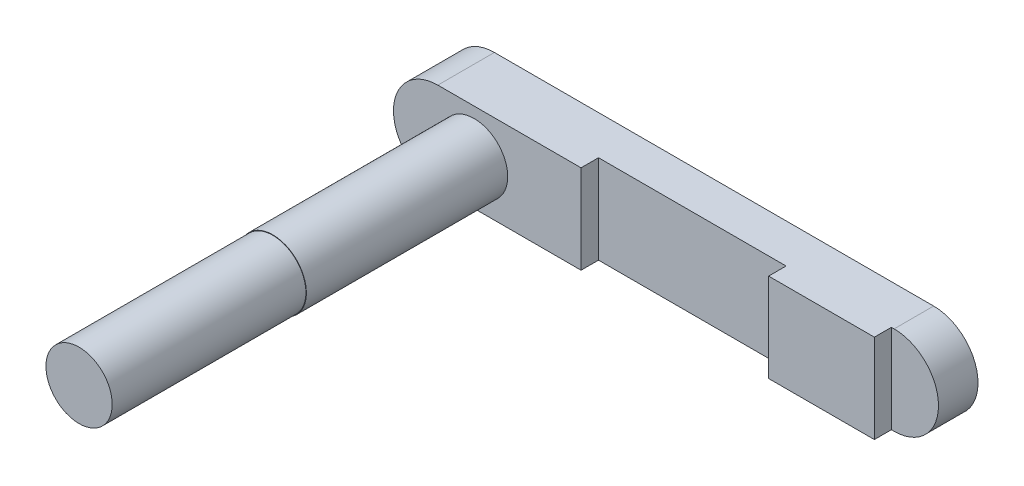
SolidWorks part; units mm, degrees
ref_plane "front" through (0, 0, 0) normal (0, 0, 1) x (1, 0, 0)
ref_plane "top" through (0, 0, 0) normal (0, 1, 0) x (1, 0, 0)
ref_plane "side" through (0, 0, 0) normal (1, 0, 0) x (0, 0, -1)
sketch "Sketch1" plane through (0, 0, 0) normal (0, 0, 1) x (1, 0, 0)
  line L0 (3.1115, 3.1115) -> (33.9217, 3.1115) construction
  line L1 (3.1115, 6.223) -> (33.9217, 6.223)
  line L2 (3.1115, 0) -> (33.9217, 0)
  line L3 (0, -50) -> (0, 50) construction
  line L4 (50, 0) -> (-50, 0) construction
  arc A0 (3.1115, 6.223) -> (3.1115, 0) centre (3.1115, 3.1115) ccw
  arc A1 (33.9217, 0) -> (33.9217, 6.223) centre (33.9217, 3.1115) ccw
  point P2 (18.5166, 3.1115)
  dimension "D2" = 37.0332
  dimension "D1" = 6.223
extrude "Boss-Extrude1" add sketch "Sketch1" along normal blind 3.9675
sketch "Sketch2" plane through (0, 0, 0) normal (0, 1, 0) x (1, 0, 0)
  line L0 (-50, 0) -> (50, 0) construction
  line L1 (43.7046, -13.1568) -> (33.7312, -13.1568)
  line L2 (43.7046, -13.1568) -> (43.7046, -2.7713)
  line L3 (43.7046, -2.7713) -> (33.7312, -2.7713)
  line L4 (33.7312, -13.1568) -> (33.7312, -2.7713)
  line L5 (26.3144, -12.2221) -> (13.1572, -12.2221)
  line L6 (26.3144, -12.2221) -> (26.3144, -2.7432)
  line L7 (26.3144, -2.7432) -> (13.1572, -2.7432)
  line L8 (13.1572, -12.2221) -> (13.1572, -2.7432)
  line L9 (37.0332, -3.9675) -> (37.0332, 0) construction
  line L10 (0, -50) -> (0, 50) construction
  dimension "D1" = 2.7432
  dimension "D2" = 3.302
  dimension "D3" = 7.4168
  dimension "D4" = 13.1572
  dimension "D5" = 13.1572
extrude "Cut-Extrude1" cut sketch "Sketch2" along normal blind 9.0475
sketch "Sketch3" plane through (0, 0, 3.9675) normal (0, 0, 1) x (1, 0, 0)
  line L0 (0, -50) -> (0, 50) construction
  line L1 (33.9217, 3.1115) -> (-4.5383, 3.1115) construction
  line L2 (50, 0) -> (-50, 0) construction
  circle A0 centre (5.6578, 3.1115) radius 2.3559
  point P9 (0, 0)
  dimension "D1" = 4.7117
  dimension "D2" = 3.302
extrude "Boss-Extrude2" add sketch "Sketch3" along normal blind 27.7114
sketch "Sketch4" plane through (0, 0, 31.6789) normal (0, 0, 1) x (1, 0, 0)
  circle A0 centre (5.6578, 3.1115) radius 2.3241
  circle A1 centre (5.6578, 3.1115) radius 4.0103
  dimension "D1" = 4.6482
extrude "Cut-Extrude2" cut sketch "Sketch4" against normal blind 13.589
